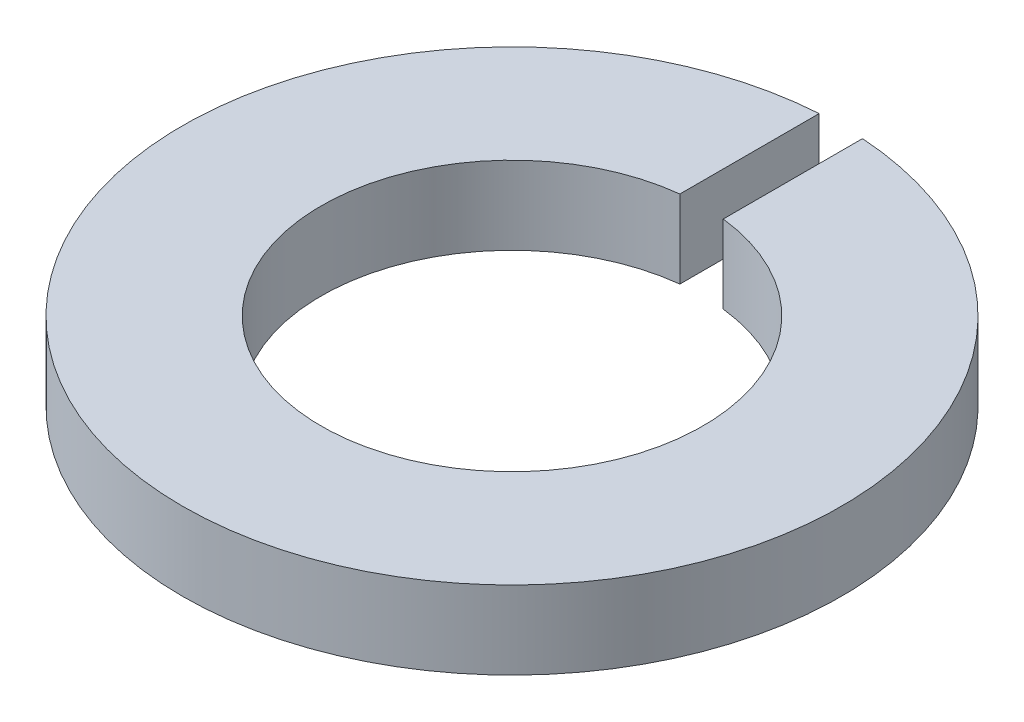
SolidWorks part; units mm, degrees
ref_plane "Front" through (0, 0, 0) normal (0, 0, 1) x (1, 0, 0)
ref_plane "Top" through (0, 0, 0) normal (0, 1, 0) x (1, 0, 0)
ref_plane "Right" through (0, 0, 0) normal (1, 0, 0) x (0, 0, -1)
sketch "Sketch1" plane through (0, 0, 0) normal (0, 1, 0) x (1, 0, 0)
  circle A0 centre (0, 0) radius 3.8
  dimension "D1" = 7.6
extrude "Base-Extrude" add sketch "Sketch1" along normal blind 0.9
sketch "Sketch2" plane through (0, 0.9, 0) normal (0, 1, 0) x (-1, 0, 0)
  line L0 (50, 0) -> (-50, 0) construction
  circle A0 centre (0, 0) radius 2.2
  circle A1 centre (0, 0) radius 3.8 construction
  dimension "D1" = 4.4
extrude "Cut-Extrude1" cut sketch "Sketch2" against normal through all
sketch "Sketch3" plane through (0, 0.9, 0) normal (0, 1, 0) x (-1, 0, 0)
  line L0 (0, 0) -> (0, -3.8) construction
  line L1 (0, 50) -> (0, -50) construction
  line L3 (-0.25, -2.1857) -> (0.25, -2.1857)
  line L4 (-0.25, -2.1857) -> (-0.25, -3.8)
  line L5 (-0.25, -3.8) -> (0.25, -3.8)
  line L6 (0.25, -2.1857) -> (0.25, -3.8)
  circle A0 centre (0, 0) radius 3.8 construction
  circle A1 centre (0, 0) radius 2.2 construction
  dimension "D1" = 0.5
extrude "Cut-Extrude2" cut sketch "Sketch3" against normal up to next
